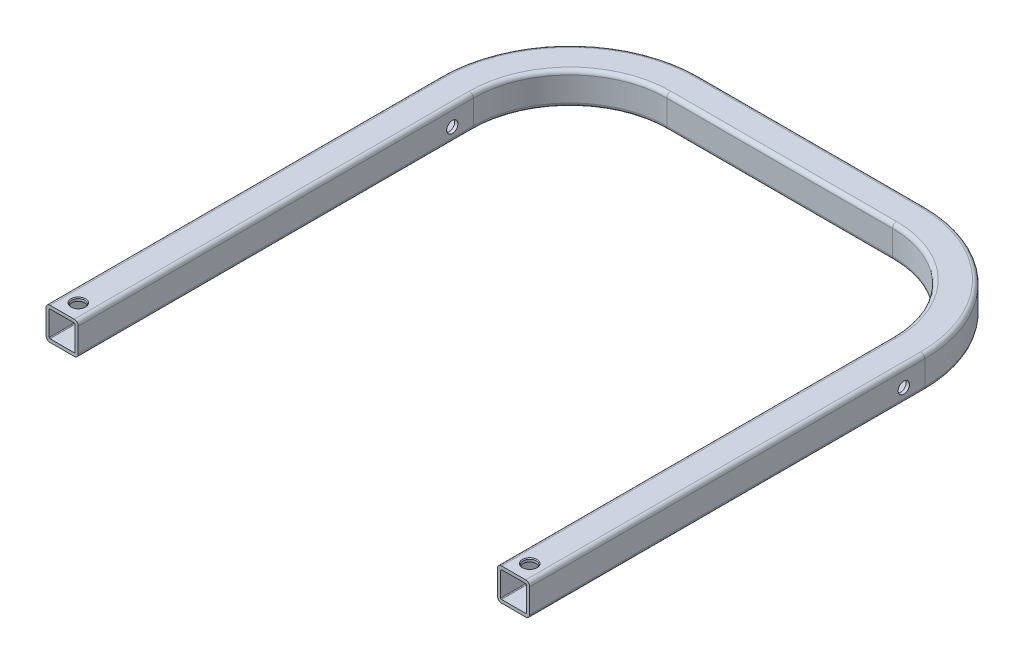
SolidWorks part; units mm, degrees
ref_plane "Plan de face" through (0, 0, 0) normal (0, 0, 1) x (1, 0, 0)
ref_plane "Plan de dessus" through (0, 0, 0) normal (0, 1, 0) x (1, 0, 0)
ref_plane "Plan de droite" through (0, 0, 0) normal (1, 0, 0) x (0, 0, -1)
sketch "Esquisse1" plane through (0, 0, 0) normal (0, 1, 0) x (1, 0, 0)
  line L0 (-150, 0) -> (-150, 245)
  line L1 (-70, 325) -> (70, 325)
  line L2 (150, 245) -> (150, 0)
  line L3 (0, 377.3045) -> (0, -42.2368) construction
  arc A0 (-150, 245) -> (-70, 325) centre (-70, 245) cw
  arc A1 (70, 325) -> (150, 245) centre (70, 245) cw
  dimension "D3" = 80
  dimension "D1" = 300
  dimension "D2" = 325
sketch "Esquisse2" plane through (0, 0, 0) normal (0, 0, 1) x (1, 0, 0)
  line L0 (-70, 0) -> (-150, 0) construction
  line L1 (-147.5, 0) -> (-132.5, 0)
  line L2 (-150, -2.5) -> (-150, -17.5)
  line L3 (-147.5, -20) -> (-132.5, -20)
  line L4 (-130, -2.5) -> (-130, -17.5)
  line L5 (-150, -2.5) -> (-150, 0) construction
  line L6 (-150, 0) -> (-147.5, 0) construction
  line L7 (-147.5, -2) -> (-132.5, -2)
  line L8 (-132, -2.5) -> (-132, -17.5)
  line L9 (-147.5, -18) -> (-132.5, -18)
  line L10 (-148, -2.5) -> (-148, -17.5)
  arc A0 (-150, -17.5) -> (-147.5, -20) centre (-147.5, -17.5) ccw
  arc A1 (-132.5, -20) -> (-130, -17.5) centre (-132.5, -17.5) ccw
  arc A2 (-132.5, 0) -> (-130, -2.5) centre (-132.5, -2.5) cw
  arc A3 (-147.5, 0) -> (-150, -2.5) centre (-147.5, -2.5) ccw
  arc A4 (-132.5, -2) -> (-132, -2.5) centre (-132.5, -2.5) cw
  arc A5 (-132.5, -18) -> (-132, -17.5) centre (-132.5, -17.5) ccw
  arc A6 (-148, -17.5) -> (-147.5, -18) centre (-147.5, -17.5) ccw
  arc A7 (-147.5, -2) -> (-148, -2.5) centre (-147.5, -2.5) ccw
  point P14 (-150, 0)
  dimension "D1" = 2.5
  dimension "D2" = 20
  dimension "D3" = 20
  dimension "D4" = 2
sweep "Balayage1" add profiles "Esquisse2" path "Esquisse1"
sketch "Esquisse3" plane through (0, 0, 0) normal (0, 1, 0) x (1, 0, 0)
  line L0 (-132.5, 0) -> (-147.5, 0) construction
  line L1 (132.5, 0) -> (147.5, 0) construction
  circle A0 centre (-140, 10) radius 4
  circle A1 centre (140, 10) radius 4
  point P6 (-140, 0)
  point P9 (140, 0)
  dimension "D1" = 8
  dimension "D2" = 10
extrude "Enlèv. mat.-Extru.1" cut sketch "Esquisse3" against normal up to next
chamfer "Chanfrein1" distance 0.5 angle 45 2 edges at (-140, 0, -6) (140, 0, -6)
sketch "Esquisse4" plane through (-150, 0, 0) normal (-1, 0, 0) x (0, 0, 1)
  line L0 (0, -2.5) -> (0, -17.5) construction
  line L1 (-245, -20) -> (0, -20) construction
  circle A0 centre (-232, -11.5) radius 3.5
  dimension "D1" = 7
  dimension "D2" = 232
  dimension "D3" = 8.5
extrude "Enlèv. mat.-Extru.2" cut sketch "Esquisse4" against normal through all
